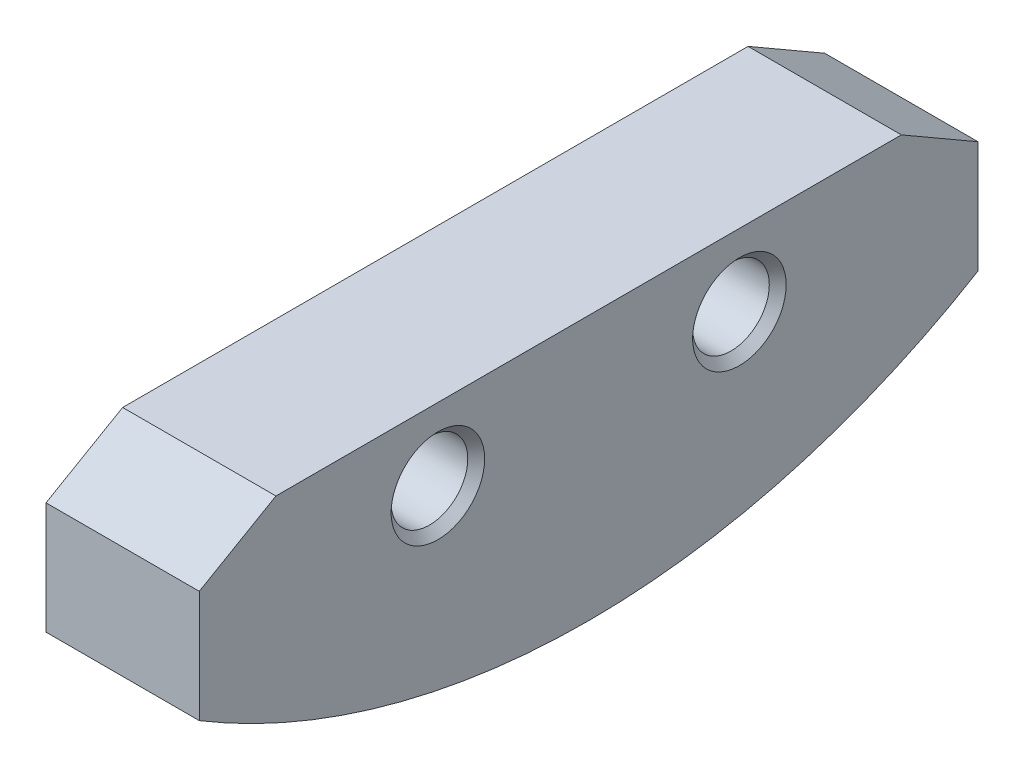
SolidWorks part; units mm, degrees
ref_plane "Front Plane" through (0, 0, 0) normal (0, 0, 1) x (1, 0, 0)
ref_plane "Top Plane" through (0, 0, 0) normal (0, 1, 0) x (1, 0, 0)
ref_plane "Right Plane" through (0, 0, 0) normal (1, 0, 0) x (0, 0, -1)
sketch "Sketch1" plane through (0, 0, 0) normal (1, 0, 0) x (0, 0, -1)
  circle A0 centre (0, 0) radius 12.5
  circle A1 centre (0, 0) radius 24.625
  circle A2 centre (0, 0) radius 19 construction
  dimension "D1" = 49.25
  dimension "D2" = 25
  dimension "D3" = 38
extrude "Boss-Extrude1" add sketch "Sketch1" along normal mid plane 5
hole_wizard "Ø3.0 (3) Diameter Hole1" positions "Sketch3" profile "Sketch2" hole size "Ø3.0" standard "Ansi Metric"
sketch "Sketch3" plane through (2.5, 0, 0) normal (1, 0, 0) x (0, 0, -1)
  line L0 (0, 0) -> (13.435, 13.435) construction
  line L1 (0, 0) -> (8.7822, 0) construction
  circle A1 centre (0, 0) radius 19 construction
  point P0 (13.435, 13.435)
  dimension "D2" = 45
sketch "Sketch2" plane through (2.5, 13.435, -13.435) normal (0, 1, 0) x (0, 0, -1)
  line L0 (0, 0) -> (0, 5)
  line L1 (0, 5) -> (3.01, 5)
  line L2 (3.01, 5) -> (3.01, 0)
  line L5 (3.01, 0) -> (0, 0)
  line L11 (0, -6.35) -> (0, 107.95) construction
  dimension "Thru Hole Dia." = 6.02
  dimension "Thru Hole Depth" = 5
hole_wizard "CBORE for M4 SHCS1" positions "Sketch5" profile "Sketch4" counterbore size "M4" standard "Ansi Metric"
sketch "Sketch5" plane through (2.5, 0, 0) normal (1, 0, 0) x (0, 0, -1)
  line L0 (18.3526, 4.9176) -> (0, 0) construction
  line L1 (0, 0) -> (13.435, 13.435) construction
  circle A1 centre (0, 0) radius 19 construction
  point P0 (18.3526, 4.9176)
  dimension "D1" = 30
sketch "Sketch4" plane through (2.5, 4.9176, -18.3526) normal (0, 1, 0) x (0, 0, -1)
  line L0 (0, 0) -> (0, 5)
  line L1 (0, 5) -> (1.525, 5)
  line L3 (1.525, 5) -> (1.525, 3.2)
  line L4 (1.525, 3.2) -> (3, 3.2)
  line L5 (3, 3.2) -> (3, 0)
  line L7 (3, 0) -> (0, 0)
  line L11 (0, -6.35) -> (0, 107.95) construction
  dimension "Thru Hole Dia." = 3.05
  dimension "Thru Hole Depth" = 5
  dimension "C'Bore Dia." = 6
  dimension "C'Bore Depth" = 3.2
pattern_circular "CirPattern2" count 2 every 60 about axis through (2.5, 0, 0) along (-1, 0, 0) of "CBORE for M4 SHCS1"
sketch "Sketch7" plane through (2.5, 0, 0) normal (1, 0, 0) x (0, 0, -1)
  line L0 (-18.7187, -16) -> (18.7187, -16)
  line L2 (0, 0) -> (0, 6.5741) construction
  circle A1 centre (0, 0) radius 24.625 construction
  arc A2 (18.7187, -16) -> (-18.7187, -16) centre (0, 0) ccw
  circle A5 centre (0, 0) radius 12.5 construction
  dimension "D1" = 3.5
extrude "Cut-Extrude1" cut sketch "Sketch7" against normal up to next
hole_wizard "M3x0.5 Tapped Hole1" positions "Sketch13" profile "Sketch12" tap size "M3x0.5" standard "Ansi Metric"
sketch "Sketch13" plane through (2.5, 0, 0) normal (1, 0, 0) x (0, 0, -1)
  circle A0 centre (0, 0) radius 19 construction
  point P0 (4.9175, -18.3526)
  dimension "D2" = 38
  dimension "D1" = 4.9175
sketch "Sketch12" plane through (2.5, -18.3526, -4.9175) normal (0, 1, 0) x (0, 0, -1)
  line L0 (0, 0) -> (0, 3.5)
  line L1 (0, 3.5) -> (1.25, 3.5)
  line L2 (1.25, 3.5) -> (1.25, 0.275)
  line L3 (1.25, 0.275) -> (1.525, 0)
  line L5 (1.525, 0) -> (0, 0)
  line L6 (-1.25, 0.275) -> (-1.525, 0) construction
  line L10 (0, 3.5) -> (-1.25, 3.5) construction
  line L11 (0, -6.35) -> (0, 107.95) construction
  dimension "Tap Drill Dia." = 2.5
  dimension "Tap Drill Depth" = 3.5
  dimension "Near C'Sink Dia." = 3.05
  dimension "Near C'Sink Angle" = 90
  dimension "Drill Angle" = 180
mirror "Mirror2" about plane through (0, 0, 0) normal (0, 0, 1) of "M3x0.5 Tapped Hole1"
ref_plane "Plane1" through (0, 0, -20) normal (0, 0, 1) x (1, 0, 0)
sketch "Sketch22" plane through (2.5, 0, 0) normal (1, 0, 0) x (0, 0, -1)
  line L1 (-20.4795, -12.8917) -> (-12.7, -12.8917)
  line L2 (-20.4795, -12.8917) -> (-20.4795, -24.0497)
  line L3 (-20.4795, -24.0497) -> (-12.7, -24.0497)
  line L4 (-12.7, -12.8917) -> (-12.7, -24.0497)
  circle A0 centre (-4.9175, -18.3526) radius 1.525 construction
  dimension "D1" = 7.7825
extrude "Cut-Extrude4" cut sketch "Sketch22" against normal up to next
mirror "Mirror5" about plane through (0, 0, 0) normal (0, 0, 1) of "Cut-Extrude4"
chamfer "Chamfer1" distance 2.5 angle 30 2 edges at (0, -16, -12.7) (0, -16, 12.7)
